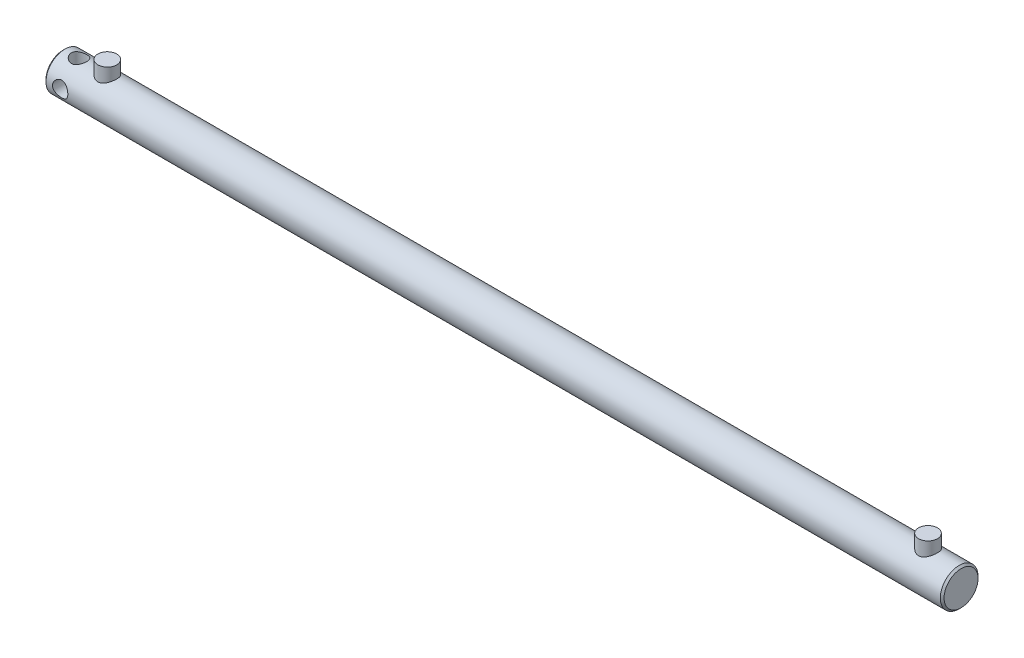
SolidWorks part; units mm, degrees
ref_plane "Plan de face" through (0, 0, 0) normal (0, 0, 1) x (1, 0, 0)
ref_plane "Plan de dessus" through (0, 0, 0) normal (0, 1, 0) x (1, 0, 0)
ref_plane "Plan de droite" through (0, 0, 0) normal (1, 0, 0) x (0, 0, -1)
sketch "Esquisse1" plane through (0, 0, 0) normal (0, 0, 1) x (1, 0, 0)
  line L0 (-476, 0) -> (476, 0) construction
  line L1 (-476, 0) -> (-476, 20)
  line L2 (-476, 20) -> (476, 20)
  line L3 (476, 20) -> (476, 0)
  line L6 (-476, 0) -> (476, 0)
  dimension "D1" = 40
  dimension "D3" = 952
revolve "Révolution1" add sketch "Esquisse1" angle 360 about L0
chamfer "Chanfrein1" distance 2 angle 45 2 edges at (476, 0, 20) (-476, 0, 20)
sketch "Esquisse3" plane through (0, 0, 0) normal (0, 0, 1) x (1, 0, 0)
  line L0 (-476, 18) -> (-476, -18) construction
  circle A0 centre (-459, 0) radius 8.1
  dimension "D1" = 16.2
  dimension "D2" = 17
extrude "Enlèv. mat.-Extru.1" cut sketch "Esquisse3" against normal through all and the other way through all
sketch "Esquisse5" plane through (0, 0, 0) normal (0, 1, 0) x (1, 0, 0)
  line L0 (-476, 18) -> (-476, -18) construction
  line L1 (476, -18) -> (476, 18) construction
  circle A0 centre (-429, 0) radius 10
  circle A1 centre (441, 0) radius 10
  dimension "D1" = 20
  dimension "D2" = 47
  dimension "D3" = 35
extrude "Extrusion2" add sketch "Esquisse5" along normal blind 33
sketch "Esquisse6" plane through (0, 0, 0) normal (0, 1, 0) x (1, 0, 0)
  line L0 (-29.15, 0) -> (29.15, 0) construction
  line L1 (-476, 18) -> (-476, -18) construction
  circle A0 centre (-459, 0) radius 8.1
  dimension "D1" = 16.2
  dimension "D2" = 17
extrude "Enlèv. mat.-Extru.2" cut sketch "Esquisse6" against normal up to next and the other way up to next
